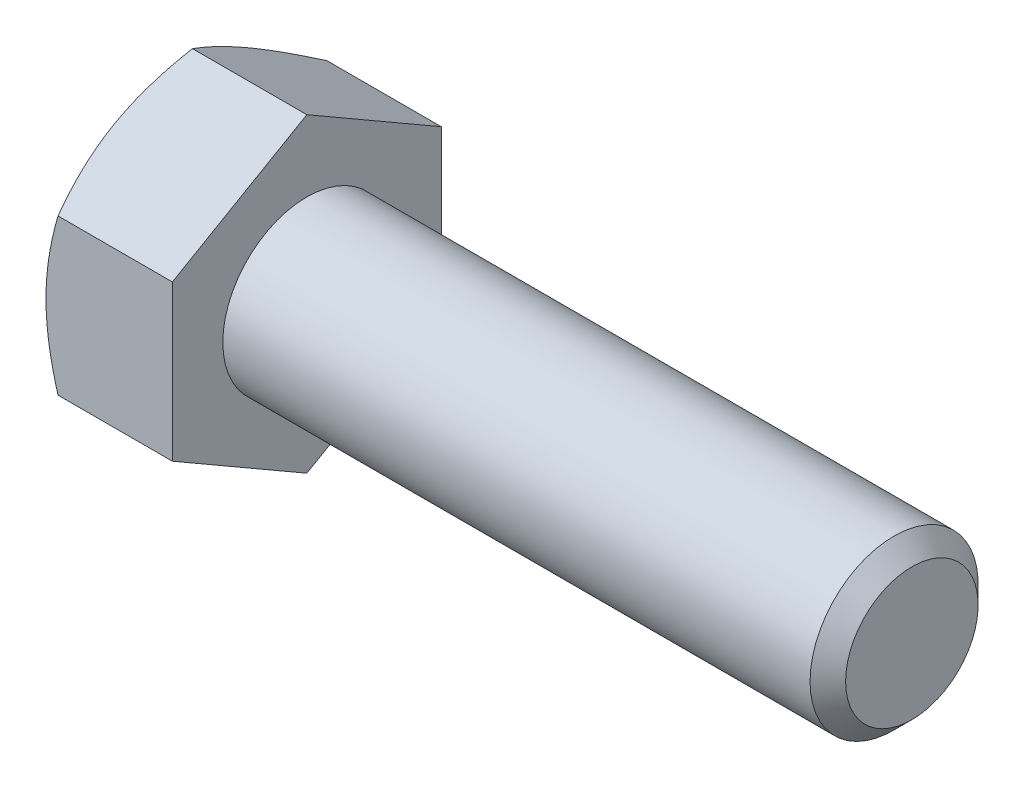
SolidWorks part; units mm, degrees
ref_plane "Plane1" through (0, 0, 0) normal (0, 0, 1) x (1, 0, 0)
ref_plane "Plane2" through (0, 0, 0) normal (0, 1, 0) x (1, 0, 0)
ref_plane "Plane3" through (0, 0, 0) normal (1, 0, 0) x (0, 0, -1)
extrude "BaseHead" add sketch "Sketch1" along normal blind 5.969
sketch "Sketch1" plane through (0, 0, 0) normal (1, 0, 0) x (0, 0, -1)
  line L0 (6.35, 3.6662) -> (6.35, -3.6662)
  line L1 (-6.35, 3.6662) -> (-6.35, -3.6662)
  line L2 (6.35, -3.6662) -> (0, -7.3323)
  line L3 (0, -7.3323) -> (-6.35, -3.6662)
  line L4 (6.35, 3.6662) -> (0, 7.3323)
  line L5 (0, 7.3323) -> (-6.35, 3.6662)
  dimension "Width_flats" = 12.7
  dimension "D2" = 120
  dimension "D3" = 6.35
  dimension "D4" = 6.35
  dimension "D5" = 6.35
revolve "BaseBody" add sketch "BodySke" angle 360 about L7
sketch "BodySke" plane through (0, 0, 0) normal (0, 0, 1) x (1, 0, 0)
  line L0 (0, 3.6662) -> (0, -3.6662) construction
  line L1 (0, 0) -> (34.544, 0)
  line L2 (0, 0) -> (0, 3.9688)
  line L3 (0, 3.9688) -> (33.7045, 3.9688)
  line L4 (34.544, 0) -> (34.544, 3.1293)
  line L5 (5.969, 7.3323) -> (5.969, 3.6662) construction
  line L6 (34.544, 3.1293) -> (33.7045, 3.9688)
  line L7 (0, 0) -> (96.52, 0) construction
  line L8 (34.544, -3.1293) -> (33.7045, -3.9688) construction
  line L9 (0, -3.9688) -> (33.7045, -3.9688) construction
  line L10 (7.3787, 15.24) -> (7.3787, -2.54) construction
  line L11 (5.969, 15.24) -> (5.969, -2.54) construction
  line L12 (5.969, 3.6662) -> (5.969, -3.6662) construction
  dimension "Length" = 28.575
  dimension "Body_ch_ang" = 45
  dimension "Diameter" = 7.9375
  dimension "Minor_dia" = 6.2586
  dimension "Advance" = 1.4097
  dimension "Thread_nom" = 28.575
sketch "Sketch3" plane through (0, 0, 0) normal (0, 0, 1) x (1, 0, 0)
  line L0 (0, 6.35) -> (4.2333, 13.6823)
  line L1 (0, 7.3323) -> (0, 3.6662) construction
  line L2 (4.2333, 13.6823) -> (4.2333, 20.0323)
  line L3 (4.2333, 20.0323) -> (-12.7, 20.0323)
  line L4 (-12.7, 20.0323) -> (-12.7, 6.35)
  line L5 (-12.7, 6.35) -> (0, 6.35)
  line L6 (0, 0) -> (99.06, 0) construction
  line L7 (5.969, 7.3323) -> (0, 7.3323) construction
  dimension "D1" = 6.35
  dimension "D2" = 6.35
  dimension "D3" = 12.7
  dimension "D4" = 6.35
  dimension "Head_ch_ang" = 30
revolve "HeadChamfer" cut sketch "Sketch3" angle 360 about L6
fillet "HeadFillet" radius 0.762
sketch "ThdSchSke" plane through (0, 0, 0) normal (0, 0, 1) x (1, 0, 0)
  line L0 (7.3787, -3.1293) -> (6.7909, -3.9688)
  line L1 (7.3787, -3.1293) -> (7.9665, -3.9688)
  line L2 (7.9665, -3.9688) -> (7.9665, -4.9609)
  line L3 (-3.175, 0) -> (5.1513, 0) construction
  line L5 (7.9665, -4.9609) -> (6.7909, -4.9609)
  line L6 (6.7909, -4.9609) -> (6.7909, -3.9688)
  dimension "Thread_minor" = 6.2586
  dimension "Diameter" = 7.9375
  dimension "Start" = 7.3787
  dimension "SideAngle" = 55
  dimension "VeeAngle" = 70
  dimension "Overcut" = 9.9219
revolve "ThreadSchematic" cut sketch "ThdSchSke" angle 360 about L3
pattern_linear "ThdSchPat"
equation "\"D3@Sketch1\" = \"Width_flats@Sketch1\" / 2"
equation "\"D4@Sketch1\" = \"D3@Sketch1\""
equation "\"D5@Sketch1\" = \"D4@Sketch1\""
equation "\"Thread_minor@ThreadCosmetic\" = \"Minor_dia@BodySke\""
equation "\"D1@Sketch3\" = \"Width_flats@Sketch1\" / 2"
equation "\"Thread_length@ThreadCosmetic\" = ((sgn( (\"Length@BodySke\" - \"Advance@BodySke\" ) - \"Thread_nom@BodySke\" )-1)*( (\"Length@BodySke\" - \"Advance@BodySke\" ) - \"Thread_nom@BodySke\" ))/-2+ \"Thread_nom@BodySke\""
equation "\"Thread_minor@ThdSchSke\" = \"Minor_dia@BodySke\""
equation "\"Diameter@ThdSchSke\" = \"Diameter@BodySke\""
equation "\"Overcut@ThdSchSke\" = \"Diameter@BodySke\" * 1.25"
equation "\"Start@ThdSchSke\" = \"Head_ht@BaseHead\" + \"Length@BodySke\" - \"Thread_length@ThreadCosmetic\"  '---Non-countersunk---"
equation "\"Num_threads@ThdSchPat\" = int( \"Thread_length@ThreadCosmetic\" / \"Advance@BodySke\" + 0.999 )  + 1"
equation "\"Advance@ThdSchPat\" = \"Thread_length@ThreadCosmetic\" /  (\"Num_threads@ThdSchPat\" - 1) 'relax it"
equation "\"Num_threads@ThdSchPat\" = \"Num_threads@ThdSchPat\" - sgn( \"Num_threads@ThdSchPat\" - 1) '---chamfered tips only---"
